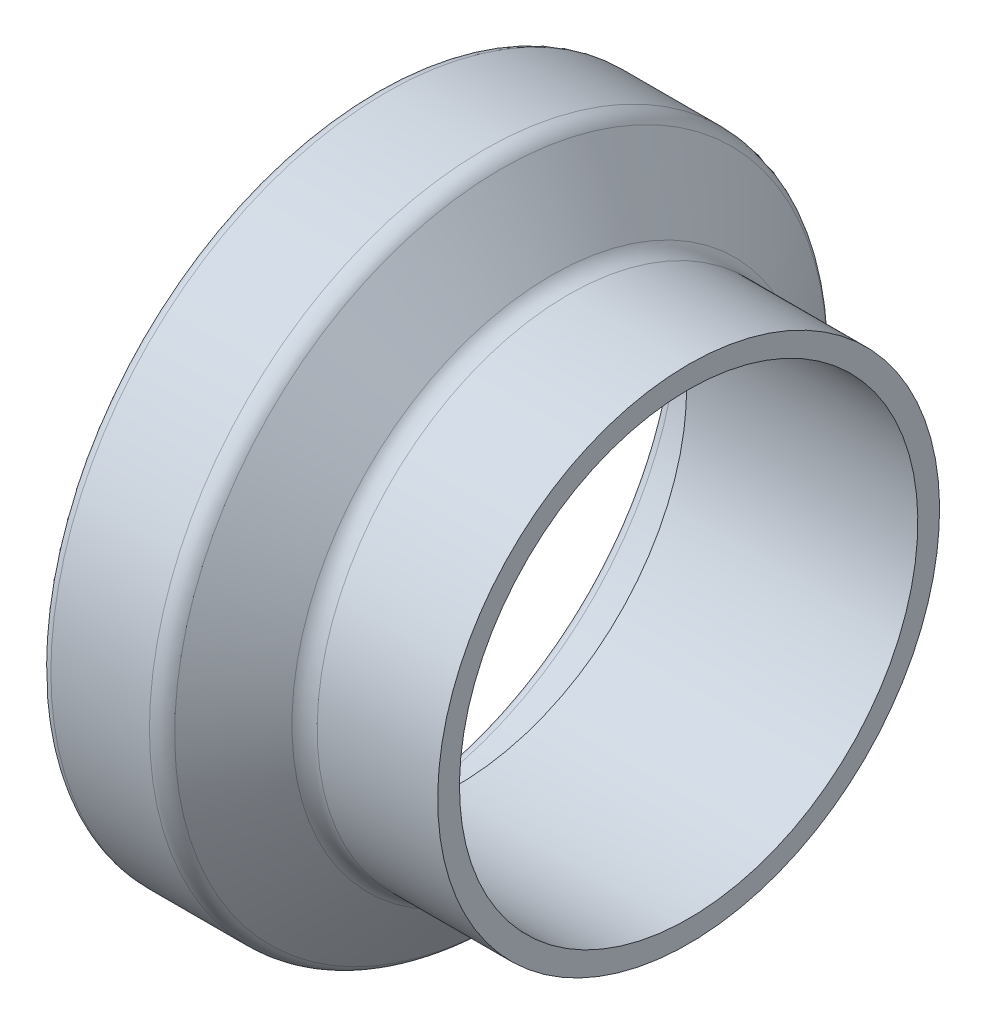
SolidWorks part; units mm, degrees
ref_plane "Front Plane" through (0, 0, 0) normal (0, 0, 1) x (1, 0, 0)
ref_plane "Top Plane" through (0, 0, 0) normal (0, 1, 0) x (1, 0, 0)
ref_plane "Right Plane" through (0, 0, 0) normal (1, 0, 0) x (0, 0, -1)
sketch "Sketch1" plane through (0, 0, 0) normal (0, 0, 1) x (1, 0, 0)
  line L0 (0, 0) -> (-52.2554, 0) construction
  line L1 (-8.2306, 17.399) -> (-25.782, 17.399)
  line L2 (-25.782, 17.399) -> (-25.782, 21.4503)
  line L3 (-26.5948, 22.2631) -> (-31.243, 22.2631)
  line L4 (-32.0558, 23.0759) -> (-32.0558, 24.5872)
  line L5 (-31.243, 25.4) -> (-23.7604, 25.4)
  line L6 (-22.4824, 24.7628) -> (-18.6577, 19.6872)
  line L7 (-17.3797, 19.05) -> (-8.2306, 19.05)
  line L8 (-8.2306, 19.05) -> (-8.2306, 17.399)
  arc A0 (-31.243, 25.4) -> (-32.0558, 24.5872) centre (-31.243, 24.5872) ccw
  arc A1 (-32.0558, 23.0759) -> (-31.243, 22.2631) centre (-31.243, 23.0759) ccw
  arc A2 (-26.5948, 22.2631) -> (-25.782, 21.4503) centre (-26.5948, 21.4503) cw
  arc A3 (-17.3797, 19.05) -> (-18.6577, 19.6872) centre (-17.3797, 20.6502) cw
  arc A4 (-22.4824, 24.7628) -> (-23.7604, 25.4) centre (-23.7604, 23.7998) ccw
  point P13 (-32.0558, 25.4)
  point P16 (-32.0558, 22.2631)
  point P23 (-22.9626, 25.4)
  dimension "D9" = 0.8128
  dimension "D10" = 1.6002
  dimension "D1" = 25.4
  dimension "D2" = 37
  dimension "D3" = 22.2631
  dimension "D4" = 17.399
  dimension "D5" = 9.0932
  dimension "D6" = 6.2738
  dimension "D7" = 23.8252
  dimension "D8" = 19.05
revolve "Revolve1" add sketch "Sketch1" angle 360 about L0
